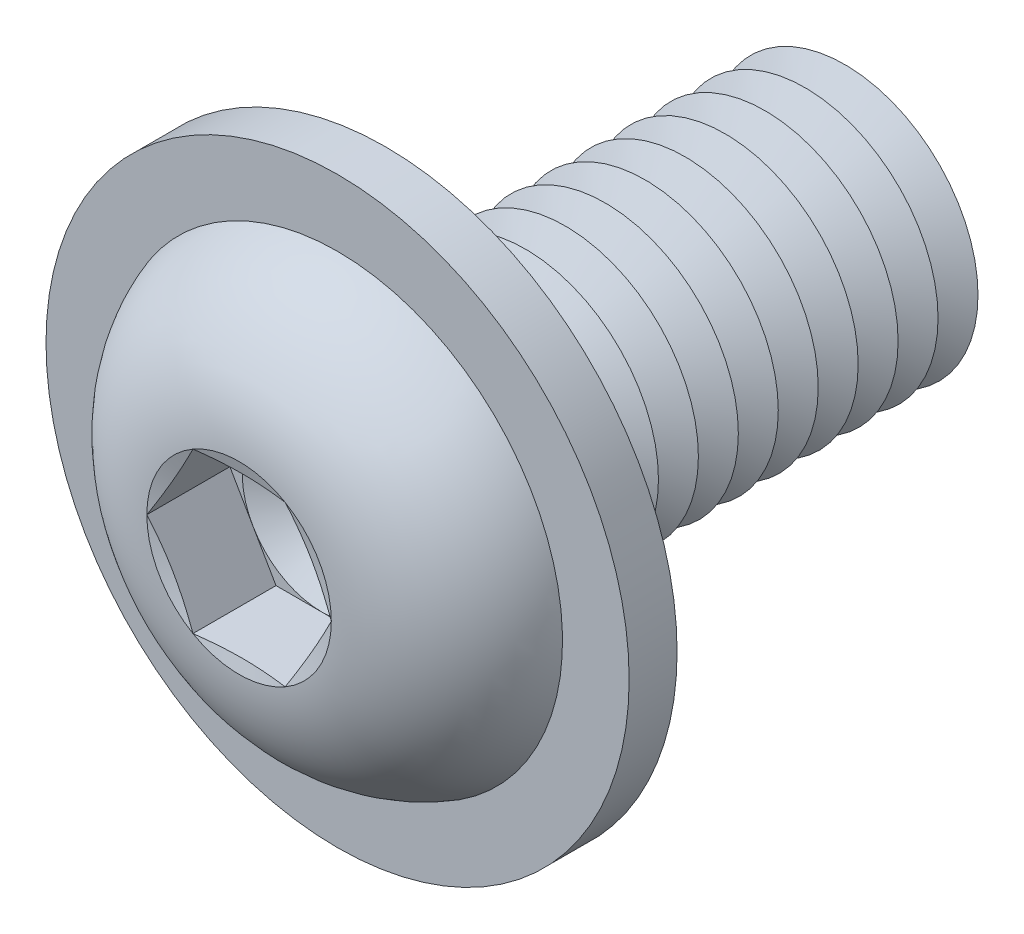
SolidWorks part; units mm, degrees
ref_plane "Front Plane" through (0, 0, 0) normal (0, 0, 1) x (1, 0, 0)
ref_plane "Top Plane" through (0, 0, 0) normal (0, 1, 0) x (1, 0, 0)
ref_plane "Right Plane" through (0, 0, 0) normal (1, 0, 0) x (0, 0, -1)
sketch "Sketch1" plane through (0, 0, 0) normal (1, 0, 0) x (0, 0, -1)
  line L0 (0, 5) -> (0, 8.75)
  line L3 (0, 5) -> (18, 5)
  line L4 (18, 5) -> (18, 0)
  line L5 (18, 0) -> (-5.5, 0) construction
  line L6 (-5.5, 0) -> (18, 0)
  line L7 (-5.5, 3.4641) -> (-5.5, 1.732) construction
  line L8 (-5.5, 1.732) -> (-5.5, 0)
  line L9 (-5.5, 3.4641) -> (-5.0359, 1.732)
  line L10 (-5.0359, 1.732) -> (-5.5, 1.732)
  line L11 (18, 0) -> (22.7481, 0) construction
  line L12 (0, 8.75) -> (-5.5, 8.75) construction
  arc A1 (0, 8.75) -> (-5.5, 3.4641) centre (0, 3.2457) ccw
  point P8 (18, 2.5)
  dimension "D1" = 17.5
  dimension "D2" = 10
  dimension "D3" = 5.5
  dimension "D4" = 6.9282
  dimension "D5" = 18
  dimension "D6" = 15
revolve "Revolve1" add sketch "Sketch1" angle 360 about L5
fillet "Fillet1" radius 0.75 1 edges at (-5, 0, 0)
sketch "Sketch2" plane through (0, 0, 0) normal (1, 0, 0) x (0, 0, -1)
  line L0 (17.25, 5) -> (18.75, 5)
  line L1 (18, 5) -> (0.75, 5) construction
  line L2 (18.75, 5) -> (18, 3.701)
  line L3 (18, -5) -> (18, 5) construction
  line L4 (18, 3.701) -> (17.25, 5)
  dimension "D1" = 1.5
revolve "Cut-Revolve1" cut sketch "Sketch2" angle 360 about axis through (0, 0, -18) along (0, 0, -1)
pattern_linear "LPattern1" count 12 spacing 1.5 along (0, 0, 1) of "Cut-Revolve1"
sketch "Sketch3" plane through (0, 0, 5.5) normal (0, 0, 1) x (1, 0, 0)
  line L7 (1.732, 3) -> (-1.7321, 3)
  line L8 (-1.7321, 3) -> (-3.4641, 0)
  line L9 (-3.4641, 0) -> (-1.732, -3)
  line L10 (-1.732, -3) -> (1.732, -3)
  line L11 (1.732, -3) -> (3.4641, 0)
  line L12 (3.4641, 0) -> (1.732, 3)
  circle A0 centre (0, 0) radius 3 construction
  circle A3 centre (0, 0) radius 3.4641 construction
extrude "Cut-Extrude1" cut sketch "Sketch3" against normal blind 3.12
sketch "Sketch4" plane through (0, 0, 2.38) normal (0, 0, 1) x (1, 0, 0)
  line L1 (1.732, 3) -> (-1.7321, 3) construction
  circle A0 centre (0, 0) radius 3
extrude "Cut-Extrude2" cut sketch "Sketch4" against normal through all draft 60
sketch "Sketch5" plane through (0, 0, 0) normal (0, 0, -1) x (-1, 0, 0)
  circle A0 centre (0, 0) radius 10.95
  circle A1 centre (0, 0) radius 5.75
  circle A2 centre (0, 0) radius 5.75 construction
  dimension "D1" = 21.9
extrude "Boss-Extrude1" add sketch "Sketch5" against normal blind 1.8
